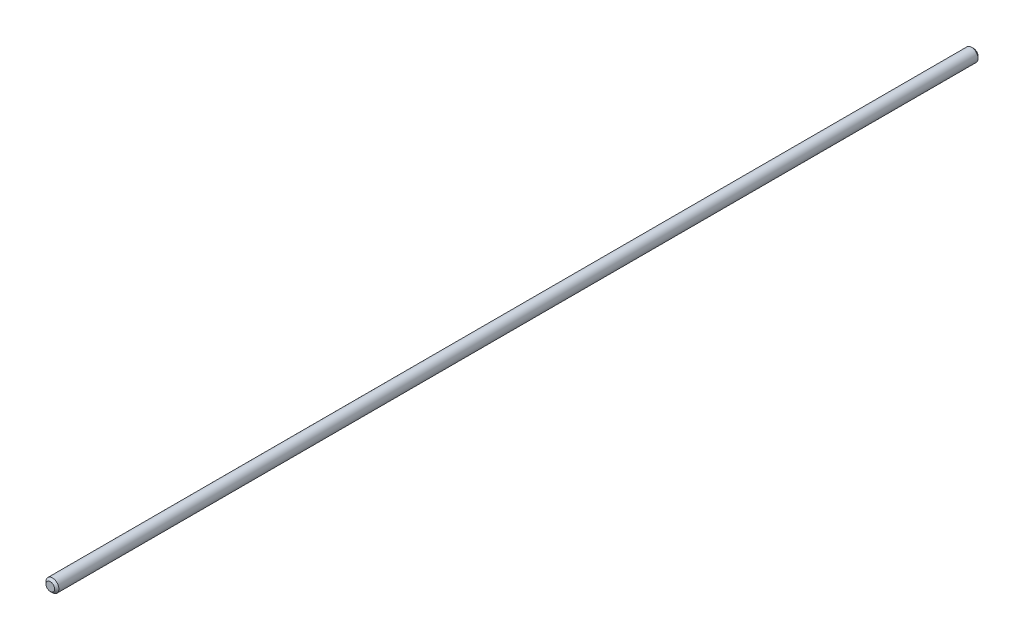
SolidWorks part; units mm, degrees
ref_plane "Plan de face" through (0, 0, 0) normal (0, 0, 1) x (1, 0, 0)
ref_plane "Plan de dessus" through (0, 0, 0) normal (0, 1, 0) x (1, 0, 0)
ref_plane "Plan de droite" through (0, 0, 0) normal (1, 0, 0) x (0, 0, -1)
sketch "Esquisse1" plane through (0, 0, 0) normal (0, 0, 1) x (1, 0, 0)
  circle A0 centre (0, 0) radius 3
extrude "Extrusion1" add sketch "Esquisse1" along normal blind 430
chamfer "Chanfrein1" distance 1 angle 45 2 edges at (3, 0, 0) (3, 0, 430)
